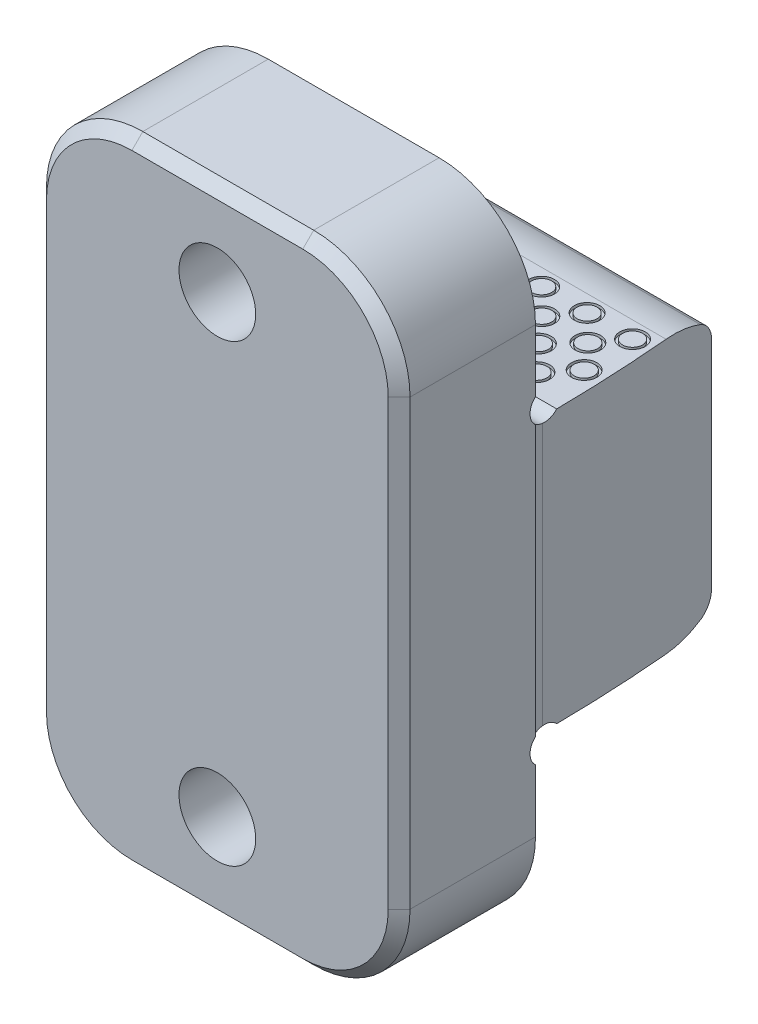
SolidWorks part; units mm, degrees
ref_plane "Front Plane" through (0, 0, 0) normal (0, 0, 1) x (1, 0, 0)
ref_plane "Top Plane" through (0, 0, 0) normal (0, 1, 0) x (1, 0, 0)
ref_plane "Right Plane" through (0, 0, 0) normal (1, 0, 0) x (0, 0, -1)
sketch "Sketch3" plane through (0, 0, 0) normal (1, 0, 0) x (0, 0, -1)
  line L0 (0, 27.94) -> (0, -27.94) construction
  line L1 (-19.05, -44.45) -> (0, -44.45)
  line L2 (-19.05, -44.45) -> (-19.05, 44.45)
  line L3 (-19.05, 44.45) -> (0, 44.45)
  line L4 (26.416, -19.0475) -> (26.416, 19.0475)
  line L6 (0, -44.45) -> (0, -19.0475)
  line L7 (0, -19.0475) -> (26.416, -19.0475)
  line L8 (0, 44.45) -> (0, 19.0475)
  line L9 (0, 19.0475) -> (26.416, 19.0475)
  line L10 (0, 0) -> (50000, 0) construction
  dimension "D1" = 45.466
  dimension "D2" = 19.05
  dimension "D3" = 88.9
  dimension "D4" = 38.0949
extrude "Extrude1" add sketch "Sketch3" along normal mid plane 50.8
sketch "Sketch7" plane through (25.4, 0, 0) normal (1, 0, 0) x (0, 0, -1)
  line L0 (0, 0) -> (50000, 0) construction
  line L1 (0, -25.4) -> (50.8, -25.4)
  line L2 (0, -25.4) -> (0, 25.4)
  line L3 (0, 25.4) -> (50.8, 25.4)
  line L4 (50.8, -25.4) -> (50.8, 25.4)
  line L5 (0, -44.45) -> (0, -19.0475) construction
  dimension "D1" = 50.8
  dimension "D2" = 50.8
extrude "Cut-Extrude3" cut sketch "Sketch7" against normal blind 0.254
mirror "Mirror2" about plane through (0, 0, 0) normal (1, 0, 0) of "Cut-Extrude3"
sketch "Sketch8" plane through (25.4, 0, 0) normal (1, 0, 0) x (0, 0, -1)
  line L0 (0, 0) -> (50000, 0) construction
  line L1 (0, -44.45) -> (0, 44.45) construction
  line L2 (0, 19.0475) -> (26.416, 19.0475) construction
  circle A0 centre (1.524, 20.5715) radius 2.286
  circle A1 centre (1.524, -20.5715) radius 2.286
  dimension "D1" = 2.286
  dimension "D2" = 0.762
  dimension "D3" = 0.762
extrude "Cut-Extrude4" cut sketch "Sketch8" against normal through all
sketch "Sketch9" plane through (25.4, 0, 0) normal (1, 0, 0) x (0, 0, -1)
  line L0 (3.2279, 19.0475) -> (26.416, 19.0475) construction
  line L1 (26.416, 19.0475) -> (26.416, -19.0475) construction
  line L2 (0, 0) -> (50000, 0) construction
  line L3 (26.416, 15.1022) -> (32.004, 15.1022)
  line L4 (19.304, 19.0475) -> (19.304, 21.4522)
  line L5 (19.304, 21.4522) -> (32.004, 21.4522)
  line L6 (32.004, 15.1022) -> (32.004, 21.4522)
  line L7 (32.004, -15.1022) -> (32.004, -21.4522)
  line L8 (19.304, -21.4522) -> (32.004, -21.4522)
  line L9 (19.304, -19.0475) -> (19.304, -21.4522)
  line L10 (26.416, -15.1022) -> (32.004, -15.1022)
  arc A0 (19.304, 19.0475) -> (24.6514, 17.8668) centre (19.304, 6.3475) cw
  arc A1 (24.6514, 17.8668) -> (26.416, 15.1022) centre (23.368, 15.1022) cw
  arc A2 (24.6514, -17.8668) -> (26.416, -15.1022) centre (23.368, -15.1022) ccw
  arc A3 (19.304, -19.0475) -> (24.6514, -17.8668) centre (19.304, -6.3475) ccw
  dimension "D1" = 3.048
  dimension "D2" = 12.7
  dimension "D3" = 7.112
  dimension "D4" = 6.35
  dimension "D5" = 12.7
extrude "Cut-Extrude5" cut sketch "Sketch9" against normal through all
sketch "Sketch13" plane through (0, 44.45, 0) normal (0, 1, 0) x (1, 0, 0)
  line L0 (25.146, 3.2279) -> (25.146, 19.304) construction
  line L2 (22.6502, 33.02) -> (35.3502, 33.02)
  line L4 (25.146, 1.27) -> (35.3502, 1.27)
  line L5 (35.3502, 33.02) -> (35.3502, 1.27)
  arc A0 (22.6502, 33.02) -> (25.146, 1.27) centre (-178.054, 1.27) cw
  dimension "D1" = 203.2
  dimension "D2" = 1.27
  dimension "D3" = 31.75
  dimension "D4" = 12.7
extrude "Cut-Extrude6" cut sketch "Sketch13" against normal through all
sketch "Sketch15" plane through (0, 19.0475, 0) normal (0, 1, 0) x (1, 0, 0)
  line L0 (-25.4, 19.304) -> (-25.4, -0.1799) construction
  line L1 (-25.4, 0) -> (-25.4, -19.05) construction
  line L2 (25.4, -19.05) -> (-25.4, -19.05) construction
  circle A0 centre (-16.1036, 16.9672) radius 1.778
  circle A1 centre (-16.1036, 16.9672) radius 1.397
  circle A2 centre (-9.7536, 16.9672) radius 1.778
  circle A3 centre (-9.7536, 16.9672) radius 1.397
  circle A4 centre (-22.4536, 16.9672) radius 1.778
  circle A5 centre (-22.4536, 16.9672) radius 1.397
  circle A6 centre (-3.4036, 16.9672) radius 1.778
  circle A7 centre (-3.4036, 16.9672) radius 1.397
  circle A8 centre (2.9464, 16.9672) radius 1.778
  circle A9 centre (2.9464, 16.9672) radius 1.397
  circle A10 centre (9.2964, 16.9672) radius 1.397
  circle A11 centre (9.2964, 16.9672) radius 1.778
  circle A12 centre (15.6464, 16.9672) radius 1.778
  circle A13 centre (15.6464, 16.9672) radius 1.397
  circle A14 centre (21.9964, 16.9672) radius 1.397
  circle A15 centre (21.9964, 16.9672) radius 1.778
  circle A16 centre (-12.827, 13.4112) radius 1.397
  circle A17 centre (-12.827, 13.4112) radius 1.778
  circle A18 centre (-6.4008, 13.4112) radius 1.397
  circle A19 centre (-6.4008, 13.4112) radius 1.778
  circle A20 centre (-19.2532, 13.4112) radius 1.397
  circle A21 centre (-19.2532, 13.4112) radius 1.778
  circle A22 centre (0.0254, 13.4112) radius 1.778
  circle A23 centre (0.0254, 13.4112) radius 1.397
  circle A24 centre (6.4516, 13.4112) radius 1.397
  circle A25 centre (6.4516, 13.4112) radius 1.778
  circle A26 centre (12.8778, 13.4112) radius 1.397
  circle A27 centre (12.8778, 13.4112) radius 1.778
  circle A28 centre (19.304, 13.4112) radius 1.397
  circle A29 centre (19.304, 13.4112) radius 1.778
  circle A32 centre (-16.0528, 9.8552) radius 1.397
  circle A33 centre (-16.0528, 9.8552) radius 1.778
  circle A34 centre (-9.652, 9.8552) radius 1.397
  circle A35 centre (-9.652, 9.8552) radius 1.778
  circle A36 centre (-22.4536, 9.8552) radius 1.397
  circle A37 centre (-22.4536, 9.8552) radius 1.778
  circle A38 centre (-3.2512, 9.8552) radius 1.397
  circle A39 centre (-3.2512, 9.8552) radius 1.778
  circle A40 centre (3.1496, 9.8552) radius 1.397
  circle A41 centre (3.1496, 9.8552) radius 1.778
  circle A42 centre (9.5504, 9.8552) radius 1.778
  circle A43 centre (9.5504, 9.8552) radius 1.397
  circle A44 centre (15.9512, 9.8552) radius 1.397
  circle A45 centre (15.9512, 9.8552) radius 1.778
  circle A46 centre (22.352, 9.8552) radius 1.397
  circle A47 centre (22.352, 9.8552) radius 1.778
  circle A48 centre (-12.827, 6.2992) radius 1.397
  circle A49 centre (-12.827, 6.2992) radius 1.778
  circle A50 centre (-6.4008, 6.2992) radius 1.397
  circle A51 centre (-6.4008, 6.2992) radius 1.778
  circle A52 centre (-19.2532, 6.2992) radius 1.397
  circle A53 centre (-19.2532, 6.2992) radius 1.778
  circle A54 centre (0.0254, 6.2992) radius 1.397
  circle A55 centre (0.0254, 6.2992) radius 1.778
  circle A56 centre (6.4516, 6.2992) radius 1.778
  circle A57 centre (6.4516, 6.2992) radius 1.397
  circle A58 centre (12.8778, 6.2992) radius 1.397
  circle A59 centre (12.8778, 6.2992) radius 1.778
  circle A60 centre (19.304, 6.2992) radius 1.397
  circle A61 centre (19.304, 6.2992) radius 1.778
  dimension "D1" = 2.9464
  dimension "D2" = 6.1468
  dimension "D12" = 3.556
  dimension "D7" = 3.556
  dimension "D8" = 2.794
  dimension "D3" = 6.35
  dimension "D4" = 6.35
  dimension "D5" = 6.35
  dimension "D6" = 6.35
  dimension "D9" = 6.35
  dimension "D10" = 6.35
  dimension "D11" = 6.35
  dimension "D13" = 3.556
  dimension "D14" = 3.556
  dimension "D15" = 36.0172
  dimension "D16" = 6.4262
  dimension "D17" = 6.4262
  dimension "D18" = 6.4262
  dimension "D19" = 6.4262
  dimension "D20" = 6.4262
  dimension "D21" = 6.4262
  dimension "D22" = 6.4008
  dimension "D23" = 6.4008
  dimension "D24" = 6.4008
  dimension "D25" = 6.4008
  dimension "D26" = 6.4008
  dimension "D27" = 6.4008
  dimension "D28" = 6.4008
  dimension "D29" = 6.4262
  dimension "D30" = 6.4262
  dimension "D31" = 6.4262
  dimension "D32" = 6.4262
  dimension "D33" = 6.4262
  dimension "D34" = 6.4262
extrude "Cut-Extrude7" cut sketch "Sketch15" against normal blind 0.381
mirror "Mirror1" about plane through (0, 0, 0) normal (0, 1, 0) of "Cut-Extrude7"
hole_wizard "3/8\"-16 CBORE" positions "Sketch11" profile "Sketch10" counterbore size "3/8" standard "Ansi Inch"
sketch "Sketch11" plane through (0, 0, 0) normal (0, 0, -1) x (-1, 0, 0)
  line L0 (0, 0) -> (0, 50000) construction
  line L1 (0, 0) -> (50000, 0) construction
  point P0 (0, 31.75)
  point P10 (0, -31.75)
  dimension "D1" = 63.5
sketch "Sketch10" plane through (0, 31.75, 0) normal (1, 0, 0) x (0, 1, 0)
  line L0 (0, 0) -> (0, 19.05)
  line L1 (0, 19.05) -> (4.7625, 19.05)
  line L3 (4.7625, 19.05) -> (4.7625, 10.32)
  line L4 (4.7625, 10.32) -> (7.9375, 10.32)
  line L5 (7.9375, 10.32) -> (7.9375, 0)
  line L7 (7.9375, 0) -> (0, 0)
  line L11 (0, -6.35) -> (0, 107.95) construction
  dimension "Thru Hole Dia." = 9.525
  dimension "Thru Hole Depth" = 19.05
  dimension "C'Bore Dia." = 15.875
  dimension "C'Bore Depth" = 10.32
hole_wizard "1/2-13 Tapped Hole1" positions "Sketch17" profile "Sketch16" tap size "1/2-13" standard "Ansi Inch"
sketch "Sketch17" plane through (0, 0, 10.32) normal (0, 0, -1) x (-1, 0, 0)
  point P0 (0, -31.75)
  point P1 (0, 31.75)
sketch "Sketch16" plane through (0, -31.75, 10.32) normal (1, 0, 0) x (0, 1, 0)
  line L0 (0, 0) -> (0, 8.73)
  line L1 (0, 8.73) -> (5.3581, 8.73)
  line L2 (5.3581, 8.73) -> (5.3581, 0)
  line L5 (5.3581, 0) -> (0, 0)
  line L11 (0, -6.35) -> (0, 107.95) construction
  dimension "Thread Major Dia." = 10.7163
  dimension "Thru Tap Drill Depth" = 8.73
fillet "Fillet1" radius 13.462 4 edges at (-25.4, 44.45, 9.525) (-25.4, -44.45, 9.525) (25.4, -44.45, 9.525) (25.4, 44.45, 9.525)
chamfer "Chamfer1" distance 1.524 angle 45 8 edges at (0, 44.45, 19.05) (-21.4571, 40.5071, 19.05) (-25.4, 0, 19.05) (0, -44.45, 19.05) (-21.4571, -40.5071, 19.05) (25.4, 0, 19.05) (21.4571, 40.5071, 19.05) (21.4571, -40.5071, 19.05)
